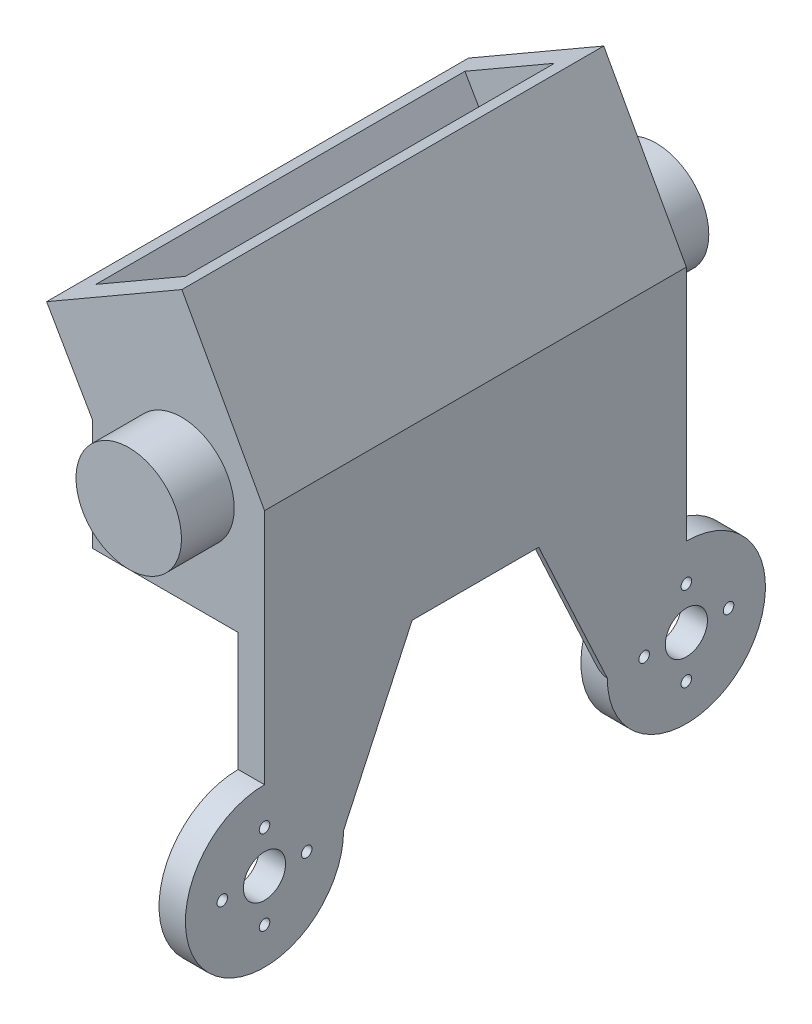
SolidWorks part; units mm, degrees
ref_plane "前视基准面" through (0, 0, 0) normal (0, 0, 1) x (1, 0, 0)
ref_plane "上视基准面" through (0, 0, 0) normal (0, 1, 0) x (1, 0, 0)
ref_plane "右视基准面" through (0, 0, 0) normal (1, 0, 0) x (0, 0, -1)
sketch "草图1" plane through (0, 0, 0) normal (1, 0, 0) x (0, 0, -1)
  line L1 (0, 0) -> (15, 0)
  line L2 (0, 0) -> (0, 60)
  line L3 (0, 60) -> (80, 60)
  line L4 (80, 0) -> (80, 60)
  line L5 (28, 28) -> (52, 28)
  line L7 (52, 0) -> (28, 0)
  line L8 (28, 28) -> (15, 0)
  line L9 (52, 28) -> (65, 0)
  line L10 (28, 0) -> (52, 0)
  line L11 (65, 0) -> (80, 0)
  circle A0 centre (0, 0) radius 15
  circle A1 centre (80, 0) radius 15
  dimension "D1" = 30
  dimension "D2" = 30
  dimension "D3" = 80
  dimension "D4" = 60
  dimension "D5" = 24
  dimension "D7" = 28
extrude "凸台-拉伸1" add sketch "草图1" along normal blind 5 contours A1 L4 L3 L2 A0 L1 | L1 A0 L2 | L2 A0 L1 | L4 A1 L1 | L1 A1 L4
sketch "草图2" plane through (0, 0, -80) normal (0, 0, -1) x (-1, 0, 0)
  line L0 (0, 60) -> (15, 85.9808)
  line L1 (0, 15) -> (0, 60) construction
  line L2 (15, 85.9808) -> (10.6699, 88.4808)
  line L3 (10.6699, 88.4808) -> (-5, 60)
  line L8 (0, 15) -> (0, 60)
  line L9 (0, 60) -> (-5, 60)
  line L10 (-5, 60) -> (-5, 15)
  line L11 (-5, 15) -> (0, 15)
  line L13 (0, 60) -> (-5, 60)
  dimension "D1" = 150
  dimension "D2" = 5
  dimension "D3" = 90
  dimension "D4" = 30
  dimension "D5" = 0
extrude "凸台-拉伸2" add sketch "草图2" against normal blind 80
sketch "草图4" plane through (0, 0, -80) normal (0, 0, -1) x (-1, 0, 0)
  line L0 (0, 37.5) -> (27.6557, 37.5)
  line L1 (0, 15) -> (0, 60) construction
  line L2 (27.6557, 37.5) -> (27.6557, 58.6606)
  line L3 (27.6557, 58.6606) -> (36.3218, 73.6706)
  line L4 (15, 85.9808) -> (36.3218, 73.6706)
  line L11 (0, 15) -> (0, 60)
  line L12 (0, 60) -> (15, 85.9808)
  line L13 (15, 85.9808) -> (10.6699, 88.4808)
  line L14 (10.6699, 88.4808) -> (-5, 60)
  line L15 (-5, 60) -> (-5, 15)
  line L16 (-5, 15) -> (0, 15)
  line L17 (0, 37.5) -> (0, 60)
  line L18 (0, 60) -> (15, 85.9808)
  dimension "D2" = 150
  dimension "D3" = 90
  dimension "D4" = 270
  dimension "D1" = 0
extrude "凸台-拉伸4" add sketch "草图4" against normal blind 80
sketch "草图5" plane through (0, 37.5, 0) normal (0, -1, 0) x (1, 0, 0)
  line L0 (-27.6557, 0) -> (-27.6557, -80) construction
  line L1 (-22.6557, -75) -> (0, -75)
  line L2 (-22.6557, -75) -> (-22.6557, -5)
  line L3 (-22.6557, -5) -> (0, -5)
  line L4 (0, -75) -> (0, -5)
  line L5 (0, 0) -> (-27.6557, 0) construction
  line L6 (0, -80) -> (-27.6557, -80) construction
  line L7 (0, 0) -> (0, -80) construction
  dimension "D1" = 5
  dimension "D2" = 5
  dimension "D3" = 5
  dimension "D4" = 0
extrude "切除-拉伸2" cut sketch "草图5" against normal blind 23.5
sketch "草图7" plane through (-40.9808, 70.9808, 0) normal (-0.5, 0.866, 0) x (0.866, 0.5, 0)
  line L0 (35, 0) -> (35, 80) construction
  line L1 (10.3798, 5) -> (30, 5)
  line L2 (10.3798, 5) -> (10.3798, 75)
  line L3 (10.3798, 75) -> (30, 75)
  line L4 (30, 5) -> (30, 75)
  line L5 (5.3798, 0) -> (5.3798, 80) construction
  line L6 (5.3798, 80) -> (35, 80) construction
  line L7 (5.3798, 0) -> (35, 0) construction
  dimension "D1" = 5
  dimension "D2" = 5
  dimension "D3" = 5
  dimension "D4" = 5
extrude "切除-拉伸4" cut sketch "草图7" against normal blind 33
sketch "草图8" plane through (0, 0, 0) normal (0, 0, 1) x (1, 0, 0)
  line L0 (0, 37.5) -> (-27.6557, 37.5) construction
  line L2 (-10.6699, 88.4808) -> (5, 60) construction
  circle A0 centre (-10.745, 57.5) radius 10
  dimension "D2" = 15
  dimension "D3" = 20
  dimension "D1" = 20
extrude "凸台-拉伸5" add sketch "草图8" along normal blind 10
sketch "草图9" plane through (0, 0, -80) normal (0, 0, -1) x (-1, 0, 0)
  line L0 (0, 37.5) -> (27.6557, 37.5) construction
  line L1 (10.6699, 88.4808) -> (-5, 60) construction
  circle A0 centre (10.745, 57.5) radius 10
  dimension "D2" = 15
  dimension "D3" = 20
  dimension "D1" = 20
extrude "凸台-拉伸6" add sketch "草图9" along normal blind 10
sketch "草图10" plane through (0, 0, 0) normal (-1, 0, 0) x (0, 0, 1)
  circle A0 centre (8, 0) radius 1
  circle A1 centre (0, -8) radius 1
  circle A2 centre (-8, 0) radius 1
  circle A3 centre (0, 8) radius 1
  circle A4 centre (0, 0) radius 4
  point P12 (0, 0)
  dimension "D1" = 2
  dimension "D4" = 8
  dimension "D2" = 8
  dimension "D3" = 4
extrude "切除-拉伸5" cut sketch "草图10" against normal up to next
sketch "草图11" plane through (0, 0, 0) normal (-1, 0, 0) x (0, 0, 1)
  circle A0 centre (-80, -8) radius 1
  arc A1 (-80, 15) -> (-65, 0) centre (-80, 0) ccw construction
  circle A2 centre (-72, 0) radius 1
  circle A3 centre (-80, 8) radius 1
  circle A4 centre (-88, 0) radius 1
  circle A5 centre (-80, 0) radius 4
  point P14 (-80, 0)
  dimension "D2" = 2
  dimension "D4" = 8
  dimension "D1" = 8
  dimension "D3" = 4
extrude "切除-拉伸6" cut sketch "草图11" against normal up to next
fillet "圆角2" radius 5 1 edges at (0, 14, -21.5)
fillet "圆角3" radius 5 1 edges at (0, 14, -58.5)
fillet "圆角4" radius 5 1 edges at (0, 28, -40)
